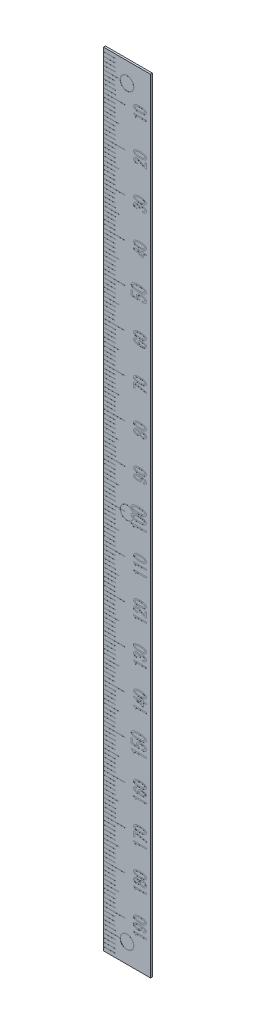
SolidWorks part; units mm, degrees
ref_plane "Front" through (0, 0, 0) normal (0, 0, 1) x (1, 0, 0)
ref_plane "Top" through (0, 0, 0) normal (0, 1, 0) x (1, 0, 0)
ref_plane "Right" through (0, 0, 0) normal (1, 0, 0) x (0, 0, -1)
sketch "Sketch1" plane through (0, 0, 0) normal (0, 0, 1) x (1, 0, 0)
  line L1 (0, 0) -> (0, 200)
  line L2 (0, 0) -> (12, 0)
  line L3 (12, 0) -> (12, 200)
  line L4 (0, 200) -> (12, 200)
  dimension "D1" = 200
  dimension "D2" = 12
extrude "Extrude1" add sketch "Sketch1" along normal blind 0.5
sketch "Sketch2" plane through (0, 0, 0.5) normal (0, 0, 1) x (1, 0, 0)
  line L0 (0, 200) -> (0, 0) construction
  line L1 (0, 0) -> (12, 0) construction
  line L2 (12, 200) -> (0, 200) construction
  circle A0 centre (6, 5) radius 1.75
  circle A1 centre (6, 195) radius 1.75
  circle A2 centre (6, 5) radius 1.65
  circle A3 centre (6, 195) radius 1.65
  circle A4 centre (6, 100) radius 1.75
  circle A5 centre (6, 100) radius 1.65
  dimension "D1" = 6
  dimension "D2" = 6
  dimension "D3" = 5
  dimension "D4" = 5
  dimension "D5" = 3.5
  dimension "D6" = 3.5
  dimension "D7" = 0.1
  dimension "D8" = 2
extrude "Extrude2" cut sketch "Sketch2" against normal blind 0.01
sketch "Sketch3" plane through (0, 0, 0.5) normal (0, 0, 1) x (1, 0, 0)
  line L0 (12, 200) -> (0, 200) construction
  line L1 (7.5, 188.25) -> (11, 188.25) construction
  line L2 (7.5, 188.25) -> (7.5, 191.75) construction
  line L3 (7.5, 191.75) -> (11, 191.75) construction
  line L4 (11, 188.25) -> (11, 191.75) construction
  line L6 (11, 178.25) -> (11, 181.75) construction
  line L7 (11, 168.25) -> (11, 171.75) construction
  line L8 (11, 158.25) -> (11, 161.75) construction
  line L9 (11, 148.25) -> (11, 151.75) construction
  line L10 (11, 138.25) -> (11, 141.75) construction
  line L11 (11, 128.25) -> (11, 131.75) construction
  line L12 (11, 118.25) -> (11, 121.75) construction
  line L13 (11, 108.25) -> (11, 111.75) construction
  line L14 (11, 47.2) -> (11, 52.8) construction
  line L15 (11, 37.2) -> (11, 42.8) construction
  line L16 (11, 98.25) -> (11, 101.75) construction
  line L17 (11, 50) -> (-4.9003, 50) construction
  line L18 (11, 27.2) -> (11, 32.8) construction
  line L19 (11, 17.2) -> (11, 22.8) construction
  line L20 (11, 7.2) -> (11, 12.8) construction
  line L21 (11, 97.2) -> (11, 102.8) construction
  line L22 (12, 0) -> (12, 200) construction
  line L23 (11, 87.2) -> (11, 92.8) construction
  line L24 (11, 57.2) -> (11, 62.8) construction
  line L25 (11, 67.2) -> (11, 72.8) construction
  line L26 (11, 77.2) -> (11, 82.8) construction
  text T0 "10" font "ＭＳ ゴシック" height in points 11
  text T1 "20" font "ＭＳ ゴシック" height in points 11
  text T2 "30" font "ＭＳ ゴシック" height in points 11
  text T3 "40" font "ＭＳ ゴシック" height in points 11
  text T4 "50" font "ＭＳ ゴシック" height in points 13
  text T5 "60  " font "ＭＳ ゴシック" height in points 11
  text T6 "70" font "ＭＳ ゴシック" height in points 11
  text T7 "80" font "ＭＳ ゴシック" height in points 11
  text T8 "90" font "ＭＳ ゴシック" height in points 11
  text T9 "150" font "ＭＳ ゴシック" height in points 13
  text T10 "160" font "ＭＳ ゴシック" height in points 11
  text T11 "170" font "ＭＳ ゴシック" height in points 11
  text T12 "180" font "ＭＳ ゴシック" height in points 11
  text T13 "190" font "ＭＳ ゴシック" height in points 11
  text T14 "100" font "ＭＳ ゴシック" height in points 13
  text T15 "110" font "ＭＳ ゴシック" height in points 11
  text T16 "120" font "ＭＳ ゴシック" height in points 11
  text T17 "130" font "ＭＳ ゴシック" height in points 11
  text T18 "140" font "ＭＳ ゴシック" height in points 11
  point P4 (11, 190)
  dimension "D1" = 3.5
  dimension "D2" = 10
  dimension "D3" = 1
  dimension "D4" = 3.5
  dimension "D8" = 5.6
  dimension "D5" = 4
  dimension "D6" = 7
  dimension "D7" = 5
  dimension "D9" = 2
  dimension "D11" = 2
extrude "Extrude3" cut sketch "Sketch3" against normal blind 0.01
sketch "Sketch4" plane through (0, 0, 0.5) normal (0, 0, 1) x (1, 0, 0)
  line L5 (12, 200) -> (0, 200) construction
  line L806 (6, 200) -> (6, 0) construction
  line L807 (0, 0) -> (12, 0) construction
  line L808 (3, 1.05) -> (3, 0.95)
  line L809 (0, 0.95) -> (3, 0.95)
  line L810 (0, 1.05) -> (3, 1.05)
  line L811 (0, 1.05) -> (0, 0.95)
  line L812 (3, 2.05) -> (3, 1.95)
  line L813 (0, 1.95) -> (3, 1.95)
  line L814 (0, 2.05) -> (3, 2.05)
  line L815 (0, 2.05) -> (0, 1.95)
  line L816 (3, 3.05) -> (3, 2.95)
  line L817 (0, 2.95) -> (3, 2.95)
  line L818 (0, 3.05) -> (3, 3.05)
  line L819 (0, 3.05) -> (0, 2.95)
  line L820 (3, 4.05) -> (3, 3.95)
  line L821 (0, 3.95) -> (3, 3.95)
  line L822 (0, 4.05) -> (3, 4.05)
  line L823 (0, 4.05) -> (0, 3.95)
  line L824 (3, 6.05) -> (3, 5.95)
  line L825 (0, 5.95) -> (3, 5.95)
  line L826 (0, 6.05) -> (3, 6.05)
  line L827 (0, 6.05) -> (0, 5.95)
  line L828 (3, 7.05) -> (3, 6.95)
  line L829 (0, 6.95) -> (3, 6.95)
  line L830 (0, 7.05) -> (3, 7.05)
  line L831 (0, 7.05) -> (0, 6.95)
  line L832 (3, 8.05) -> (3, 7.95)
  line L833 (0, 7.95) -> (3, 7.95)
  line L834 (0, 8.05) -> (3, 8.05)
  line L835 (3, 9.05) -> (3, 8.95)
  line L836 (0, 8.95) -> (3, 8.95)
  line L837 (0, 9.05) -> (0, 8.95)
  line L838 (0, 9.05) -> (3, 9.05)
  line L839 (4, 4.95) -> (4, 5.05)
  line L840 (0, 5.05) -> (4, 5.05)
  line L841 (0, 4.95) -> (0, 5.05)
  line L842 (0, 4.95) -> (4, 4.95)
  line L843 (0, 8.05) -> (0, 7.95)
  line L844 (0, 9.95) -> (0, 10.05)
  line L845 (5.5, 9.95) -> (0, 9.95)
  line L846 (5.5, 10.05) -> (5.5, 9.95)
  line L847 (0, 10.05) -> (5.5, 10.05)
  line L848 (3, 11.05) -> (3, 10.95)
  line L849 (0, 10.95) -> (3, 10.95)
  line L850 (0, 11.05) -> (3, 11.05)
  line L851 (0, 11.05) -> (0, 10.95)
  line L852 (3, 12.05) -> (3, 11.95)
  line L853 (0, 11.95) -> (3, 11.95)
  line L854 (0, 12.05) -> (3, 12.05)
  line L855 (0, 12.05) -> (0, 11.95)
  line L856 (3, 13.05) -> (3, 12.95)
  line L857 (0, 12.95) -> (3, 12.95)
  line L858 (0, 13.05) -> (3, 13.05)
  line L859 (0, 13.05) -> (0, 12.95)
  line L860 (3, 14.05) -> (3, 13.95)
  line L861 (0, 13.95) -> (3, 13.95)
  line L862 (0, 14.05) -> (3, 14.05)
  line L863 (0, 14.05) -> (0, 13.95)
  line L864 (3, 16.05) -> (3, 15.95)
  line L865 (0, 15.95) -> (3, 15.95)
  line L866 (0, 16.05) -> (3, 16.05)
  line L867 (0, 16.05) -> (0, 15.95)
  line L868 (3, 17.05) -> (3, 16.95)
  line L869 (0, 16.95) -> (3, 16.95)
  line L870 (0, 17.05) -> (3, 17.05)
  line L871 (0, 17.05) -> (0, 16.95)
  line L872 (3, 18.05) -> (3, 17.95)
  line L873 (0, 17.95) -> (3, 17.95)
  line L874 (0, 18.05) -> (3, 18.05)
  line L875 (3, 19.05) -> (3, 18.95)
  line L876 (0, 18.95) -> (3, 18.95)
  line L877 (0, 19.05) -> (0, 18.95)
  line L878 (0, 19.05) -> (3, 19.05)
  line L879 (4, 14.95) -> (4, 15.05)
  line L880 (0, 15.05) -> (4, 15.05)
  line L881 (0, 14.95) -> (0, 15.05)
  line L882 (0, 14.95) -> (4, 14.95)
  line L883 (0, 18.05) -> (0, 17.95)
  line L884 (0, 19.95) -> (0, 20.05)
  line L885 (5.5, 19.95) -> (0, 19.95)
  line L886 (5.5, 20.05) -> (5.5, 19.95)
  line L887 (0, 20.05) -> (5.5, 20.05)
  line L888 (3, 21.05) -> (3, 20.95)
  line L889 (0, 20.95) -> (3, 20.95)
  line L890 (0, 21.05) -> (3, 21.05)
  line L891 (0, 21.05) -> (0, 20.95)
  line L892 (3, 22.05) -> (3, 21.95)
  line L893 (0, 21.95) -> (3, 21.95)
  line L894 (0, 22.05) -> (3, 22.05)
  line L895 (0, 22.05) -> (0, 21.95)
  line L896 (3, 23.05) -> (3, 22.95)
  line L897 (0, 22.95) -> (3, 22.95)
  line L898 (0, 23.05) -> (3, 23.05)
  line L899 (0, 23.05) -> (0, 22.95)
  line L900 (3, 24.05) -> (3, 23.95)
  line L901 (0, 23.95) -> (3, 23.95)
  line L902 (0, 24.05) -> (3, 24.05)
  line L903 (0, 24.05) -> (0, 23.95)
  line L904 (3, 26.05) -> (3, 25.95)
  line L905 (0, 25.95) -> (3, 25.95)
  line L906 (0, 26.05) -> (3, 26.05)
  line L907 (0, 26.05) -> (0, 25.95)
  line L908 (3, 27.05) -> (3, 26.95)
  line L909 (0, 26.95) -> (3, 26.95)
  line L910 (0, 27.05) -> (3, 27.05)
  line L911 (0, 27.05) -> (0, 26.95)
  line L912 (3, 28.05) -> (3, 27.95)
  line L913 (0, 27.95) -> (3, 27.95)
  line L914 (0, 28.05) -> (3, 28.05)
  line L915 (3, 29.05) -> (3, 28.95)
  line L916 (0, 28.95) -> (3, 28.95)
  line L917 (0, 29.05) -> (0, 28.95)
  line L918 (0, 29.05) -> (3, 29.05)
  line L919 (4, 24.95) -> (4, 25.05)
  line L920 (0, 25.05) -> (4, 25.05)
  line L921 (0, 24.95) -> (0, 25.05)
  line L922 (0, 24.95) -> (4, 24.95)
  line L923 (0, 28.05) -> (0, 27.95)
  line L924 (0, 29.95) -> (0, 30.05)
  line L925 (5.5, 29.95) -> (0, 29.95)
  line L926 (5.5, 30.05) -> (5.5, 29.95)
  line L927 (0, 30.05) -> (5.5, 30.05)
  line L928 (3, 31.05) -> (3, 30.95)
  line L929 (0, 30.95) -> (3, 30.95)
  line L930 (0, 31.05) -> (3, 31.05)
  line L931 (0, 31.05) -> (0, 30.95)
  line L932 (3, 32.05) -> (3, 31.95)
  line L933 (0, 31.95) -> (3, 31.95)
  line L934 (0, 32.05) -> (3, 32.05)
  line L935 (0, 32.05) -> (0, 31.95)
  line L936 (3, 33.05) -> (3, 32.95)
  line L937 (0, 32.95) -> (3, 32.95)
  line L938 (0, 33.05) -> (3, 33.05)
  line L939 (0, 33.05) -> (0, 32.95)
  line L940 (3, 34.05) -> (3, 33.95)
  line L941 (0, 33.95) -> (3, 33.95)
  line L942 (0, 34.05) -> (3, 34.05)
  line L943 (0, 34.05) -> (0, 33.95)
  line L944 (3, 36.05) -> (3, 35.95)
  line L945 (0, 35.95) -> (3, 35.95)
  line L946 (0, 36.05) -> (3, 36.05)
  line L947 (0, 36.05) -> (0, 35.95)
  line L948 (3, 37.05) -> (3, 36.95)
  line L949 (0, 36.95) -> (3, 36.95)
  line L950 (0, 37.05) -> (3, 37.05)
  line L951 (0, 37.05) -> (0, 36.95)
  line L952 (3, 38.05) -> (3, 37.95)
  line L953 (0, 37.95) -> (3, 37.95)
  line L954 (0, 38.05) -> (3, 38.05)
  line L955 (3, 39.05) -> (3, 38.95)
  line L956 (0, 38.95) -> (3, 38.95)
  line L957 (0, 39.05) -> (0, 38.95)
  line L958 (0, 39.05) -> (3, 39.05)
  line L959 (4, 34.95) -> (4, 35.05)
  line L960 (0, 35.05) -> (4, 35.05)
  line L961 (0, 34.95) -> (0, 35.05)
  line L962 (0, 34.95) -> (4, 34.95)
  line L963 (0, 38.05) -> (0, 37.95)
  line L964 (0, 39.95) -> (0, 40.05)
  line L965 (5.5, 39.95) -> (0, 39.95)
  line L966 (5.5, 40.05) -> (5.5, 39.95)
  line L967 (0, 40.05) -> (5.5, 40.05)
  line L968 (3, 41.05) -> (3, 40.95)
  line L969 (0, 40.95) -> (3, 40.95)
  line L970 (0, 41.05) -> (3, 41.05)
  line L971 (0, 41.05) -> (0, 40.95)
  line L972 (3, 42.05) -> (3, 41.95)
  line L973 (0, 41.95) -> (3, 41.95)
  line L974 (0, 42.05) -> (3, 42.05)
  line L975 (0, 42.05) -> (0, 41.95)
  line L976 (3, 43.05) -> (3, 42.95)
  line L977 (0, 42.95) -> (3, 42.95)
  line L978 (0, 43.05) -> (3, 43.05)
  line L979 (0, 43.05) -> (0, 42.95)
  line L980 (3, 44.05) -> (3, 43.95)
  line L981 (0, 43.95) -> (3, 43.95)
  line L982 (0, 44.05) -> (3, 44.05)
  line L983 (0, 44.05) -> (0, 43.95)
  line L984 (3, 46.05) -> (3, 45.95)
  line L985 (0, 45.95) -> (3, 45.95)
  line L986 (0, 46.05) -> (3, 46.05)
  line L987 (0, 46.05) -> (0, 45.95)
  line L988 (3, 47.05) -> (3, 46.95)
  line L989 (0, 46.95) -> (3, 46.95)
  line L990 (0, 47.05) -> (3, 47.05)
  line L991 (0, 47.05) -> (0, 46.95)
  line L992 (3, 48.05) -> (3, 47.95)
  line L993 (0, 47.95) -> (3, 47.95)
  line L994 (0, 48.05) -> (3, 48.05)
  line L995 (3, 49.05) -> (3, 48.95)
  line L996 (0, 48.95) -> (3, 48.95)
  line L997 (0, 49.05) -> (0, 48.95)
  line L998 (0, 49.05) -> (3, 49.05)
  line L999 (4, 44.95) -> (4, 45.05)
  line L1000 (0, 45.05) -> (4, 45.05)
  line L1001 (0, 44.95) -> (0, 45.05)
  line L1002 (0, 44.95) -> (4, 44.95)
  line L1003 (0, 48.05) -> (0, 47.95)
  line L1004 (0, 49.95) -> (0, 50.05)
  line L1005 (5.5, 49.95) -> (0, 49.95)
  line L1006 (5.5, 50.05) -> (5.5, 49.95)
  line L1007 (0, 50.05) -> (5.5, 50.05)
  line L1008 (3, 51.05) -> (3, 50.95)
  line L1009 (0, 50.95) -> (3, 50.95)
  line L1010 (0, 51.05) -> (3, 51.05)
  line L1011 (0, 51.05) -> (0, 50.95)
  line L1012 (3, 52.05) -> (3, 51.95)
  line L1013 (0, 51.95) -> (3, 51.95)
  line L1014 (0, 52.05) -> (3, 52.05)
  line L1015 (0, 52.05) -> (0, 51.95)
  line L1016 (3, 53.05) -> (3, 52.95)
  line L1017 (0, 52.95) -> (3, 52.95)
  line L1018 (0, 53.05) -> (3, 53.05)
  line L1019 (0, 53.05) -> (0, 52.95)
  line L1020 (3, 54.05) -> (3, 53.95)
  line L1021 (0, 53.95) -> (3, 53.95)
  line L1022 (0, 54.05) -> (3, 54.05)
  line L1023 (0, 54.05) -> (0, 53.95)
  line L1024 (3, 56.05) -> (3, 55.95)
  line L1025 (0, 55.95) -> (3, 55.95)
  line L1026 (0, 56.05) -> (3, 56.05)
  line L1027 (0, 56.05) -> (0, 55.95)
  line L1028 (3, 57.05) -> (3, 56.95)
  line L1029 (0, 56.95) -> (3, 56.95)
  line L1030 (0, 57.05) -> (3, 57.05)
  line L1031 (0, 57.05) -> (0, 56.95)
  line L1032 (3, 58.05) -> (3, 57.95)
  line L1033 (0, 57.95) -> (3, 57.95)
  line L1034 (0, 58.05) -> (3, 58.05)
  line L1035 (3, 59.05) -> (3, 58.95)
  line L1036 (0, 58.95) -> (3, 58.95)
  line L1037 (0, 59.05) -> (0, 58.95)
  line L1038 (0, 59.05) -> (3, 59.05)
  line L1039 (4, 54.95) -> (4, 55.05)
  line L1040 (0, 55.05) -> (4, 55.05)
  line L1041 (0, 54.95) -> (0, 55.05)
  line L1042 (0, 54.95) -> (4, 54.95)
  line L1043 (0, 58.05) -> (0, 57.95)
  line L1044 (0, 59.95) -> (0, 60.05)
  line L1045 (5.5, 59.95) -> (0, 59.95)
  line L1046 (5.5, 60.05) -> (5.5, 59.95)
  line L1047 (0, 60.05) -> (5.5, 60.05)
  line L1048 (3, 61.05) -> (3, 60.95)
  line L1049 (0, 60.95) -> (3, 60.95)
  line L1050 (0, 61.05) -> (3, 61.05)
  line L1051 (0, 61.05) -> (0, 60.95)
  line L1052 (3, 62.05) -> (3, 61.95)
  line L1053 (0, 61.95) -> (3, 61.95)
  line L1054 (0, 62.05) -> (3, 62.05)
  line L1055 (0, 62.05) -> (0, 61.95)
  line L1056 (3, 63.05) -> (3, 62.95)
  line L1057 (0, 62.95) -> (3, 62.95)
  line L1058 (0, 63.05) -> (3, 63.05)
  line L1059 (0, 63.05) -> (0, 62.95)
  line L1060 (3, 64.05) -> (3, 63.95)
  line L1061 (0, 63.95) -> (3, 63.95)
  line L1062 (0, 64.05) -> (3, 64.05)
  line L1063 (0, 64.05) -> (0, 63.95)
  line L1064 (3, 66.05) -> (3, 65.95)
  line L1065 (0, 65.95) -> (3, 65.95)
  line L1066 (0, 66.05) -> (3, 66.05)
  line L1067 (0, 66.05) -> (0, 65.95)
  line L1068 (3, 67.05) -> (3, 66.95)
  line L1069 (0, 66.95) -> (3, 66.95)
  line L1070 (0, 67.05) -> (3, 67.05)
  line L1071 (0, 67.05) -> (0, 66.95)
  line L1072 (3, 68.05) -> (3, 67.95)
  line L1073 (0, 67.95) -> (3, 67.95)
  line L1074 (0, 68.05) -> (3, 68.05)
  line L1075 (3, 69.05) -> (3, 68.95)
  line L1076 (0, 68.95) -> (3, 68.95)
  line L1077 (0, 69.05) -> (0, 68.95)
  line L1078 (0, 69.05) -> (3, 69.05)
  line L1079 (4, 64.95) -> (4, 65.05)
  line L1080 (0, 65.05) -> (4, 65.05)
  line L1081 (0, 64.95) -> (0, 65.05)
  line L1082 (0, 64.95) -> (4, 64.95)
  line L1083 (0, 68.05) -> (0, 67.95)
  line L1084 (0, 69.95) -> (0, 70.05)
  line L1085 (5.5, 69.95) -> (0, 69.95)
  line L1086 (5.5, 70.05) -> (5.5, 69.95)
  line L1087 (0, 70.05) -> (5.5, 70.05)
  line L1088 (3, 71.05) -> (3, 70.95)
  line L1089 (0, 70.95) -> (3, 70.95)
  line L1090 (0, 71.05) -> (3, 71.05)
  line L1091 (0, 71.05) -> (0, 70.95)
  line L1092 (3, 72.05) -> (3, 71.95)
  line L1093 (0, 71.95) -> (3, 71.95)
  line L1094 (0, 72.05) -> (3, 72.05)
  line L1095 (0, 72.05) -> (0, 71.95)
  line L1096 (3, 73.05) -> (3, 72.95)
  line L1097 (0, 72.95) -> (3, 72.95)
  line L1098 (0, 73.05) -> (3, 73.05)
  line L1099 (0, 73.05) -> (0, 72.95)
  line L1100 (3, 74.05) -> (3, 73.95)
  line L1101 (0, 73.95) -> (3, 73.95)
  line L1102 (0, 74.05) -> (3, 74.05)
  line L1103 (0, 74.05) -> (0, 73.95)
  line L1104 (3, 76.05) -> (3, 75.95)
  line L1105 (0, 75.95) -> (3, 75.95)
  line L1106 (0, 76.05) -> (3, 76.05)
  line L1107 (0, 76.05) -> (0, 75.95)
  line L1108 (3, 77.05) -> (3, 76.95)
  line L1109 (0, 76.95) -> (3, 76.95)
  line L1110 (0, 77.05) -> (3, 77.05)
  line L1111 (0, 77.05) -> (0, 76.95)
  line L1112 (3, 78.05) -> (3, 77.95)
  line L1113 (0, 77.95) -> (3, 77.95)
  line L1114 (0, 78.05) -> (3, 78.05)
  line L1115 (3, 79.05) -> (3, 78.95)
  line L1116 (0, 78.95) -> (3, 78.95)
  line L1117 (0, 79.05) -> (0, 78.95)
  line L1118 (0, 79.05) -> (3, 79.05)
  line L1119 (4, 74.95) -> (4, 75.05)
  line L1120 (0, 75.05) -> (4, 75.05)
  line L1121 (0, 74.95) -> (0, 75.05)
  line L1122 (0, 74.95) -> (4, 74.95)
  line L1123 (0, 78.05) -> (0, 77.95)
  line L1124 (0, 79.95) -> (0, 80.05)
  line L1125 (5.5, 79.95) -> (0, 79.95)
  line L1126 (5.5, 80.05) -> (5.5, 79.95)
  line L1127 (0, 80.05) -> (5.5, 80.05)
  line L1128 (3, 81.05) -> (3, 80.95)
  line L1129 (0, 80.95) -> (3, 80.95)
  line L1130 (0, 81.05) -> (3, 81.05)
  line L1131 (0, 81.05) -> (0, 80.95)
  line L1132 (3, 82.05) -> (3, 81.95)
  line L1133 (0, 81.95) -> (3, 81.95)
  line L1134 (0, 82.05) -> (3, 82.05)
  line L1135 (0, 82.05) -> (0, 81.95)
  line L1136 (3, 83.05) -> (3, 82.95)
  line L1137 (0, 82.95) -> (3, 82.95)
  line L1138 (0, 83.05) -> (3, 83.05)
  line L1139 (0, 83.05) -> (0, 82.95)
  line L1140 (3, 84.05) -> (3, 83.95)
  line L1141 (0, 83.95) -> (3, 83.95)
  line L1142 (0, 84.05) -> (3, 84.05)
  line L1143 (0, 84.05) -> (0, 83.95)
  line L1144 (3, 86.05) -> (3, 85.95)
  line L1145 (0, 85.95) -> (3, 85.95)
  line L1146 (0, 86.05) -> (3, 86.05)
  line L1147 (0, 86.05) -> (0, 85.95)
  line L1148 (3, 87.05) -> (3, 86.95)
  line L1149 (0, 86.95) -> (3, 86.95)
  line L1150 (0, 87.05) -> (3, 87.05)
  line L1151 (0, 87.05) -> (0, 86.95)
  line L1152 (3, 88.05) -> (3, 87.95)
  line L1153 (0, 87.95) -> (3, 87.95)
  line L1154 (0, 88.05) -> (3, 88.05)
  line L1155 (3, 89.05) -> (3, 88.95)
  line L1156 (0, 88.95) -> (3, 88.95)
  line L1157 (0, 89.05) -> (0, 88.95)
  line L1158 (0, 89.05) -> (3, 89.05)
  line L1159 (4, 84.95) -> (4, 85.05)
  line L1160 (0, 85.05) -> (4, 85.05)
  line L1161 (0, 84.95) -> (0, 85.05)
  line L1162 (0, 84.95) -> (4, 84.95)
  line L1163 (0, 88.05) -> (0, 87.95)
  line L1164 (0, 89.95) -> (0, 90.05)
  line L1165 (5.5, 89.95) -> (0, 89.95)
  line L1166 (5.5, 90.05) -> (5.5, 89.95)
  line L1167 (0, 90.05) -> (5.5, 90.05)
  line L1168 (3, 91.05) -> (3, 90.95)
  line L1169 (0, 90.95) -> (3, 90.95)
  line L1170 (0, 91.05) -> (3, 91.05)
  line L1171 (0, 91.05) -> (0, 90.95)
  line L1172 (3, 92.05) -> (3, 91.95)
  line L1173 (0, 91.95) -> (3, 91.95)
  line L1174 (0, 92.05) -> (3, 92.05)
  line L1175 (0, 92.05) -> (0, 91.95)
  line L1176 (3, 93.05) -> (3, 92.95)
  line L1177 (0, 92.95) -> (3, 92.95)
  line L1178 (0, 93.05) -> (3, 93.05)
  line L1179 (0, 93.05) -> (0, 92.95)
  line L1180 (3, 94.05) -> (3, 93.95)
  line L1181 (0, 93.95) -> (3, 93.95)
  line L1182 (0, 94.05) -> (3, 94.05)
  line L1183 (0, 94.05) -> (0, 93.95)
  line L1184 (3, 96.05) -> (3, 95.95)
  line L1185 (0, 95.95) -> (3, 95.95)
  line L1186 (0, 96.05) -> (3, 96.05)
  line L1187 (0, 96.05) -> (0, 95.95)
  line L1188 (3, 97.05) -> (3, 96.95)
  line L1189 (0, 96.95) -> (3, 96.95)
  line L1190 (0, 97.05) -> (3, 97.05)
  line L1191 (0, 97.05) -> (0, 96.95)
  line L1192 (3, 98.05) -> (3, 97.95)
  line L1193 (0, 97.95) -> (3, 97.95)
  line L1194 (0, 98.05) -> (3, 98.05)
  line L1195 (3, 99.05) -> (3, 98.95)
  line L1196 (0, 98.95) -> (3, 98.95)
  line L1197 (0, 99.05) -> (0, 98.95)
  line L1198 (0, 99.05) -> (3, 99.05)
  line L1199 (4, 94.95) -> (4, 95.05)
  line L1200 (0, 95.05) -> (4, 95.05)
  line L1201 (0, 94.95) -> (0, 95.05)
  line L1202 (0, 94.95) -> (4, 94.95)
  line L1203 (0, 98.05) -> (0, 97.95)
  line L1204 (0, 99.95) -> (0, 100.05)
  line L1205 (5.5, 99.95) -> (0, 99.95)
  line L1206 (5.5, 100.05) -> (5.5, 99.95)
  line L1207 (0, 100.05) -> (5.5, 100.05)
  line L1208 (3, 101.05) -> (3, 100.95)
  line L1209 (0, 100.95) -> (3, 100.95)
  line L1210 (0, 101.05) -> (3, 101.05)
  line L1211 (0, 101.05) -> (0, 100.95)
  line L1212 (3, 102.05) -> (3, 101.95)
  line L1213 (0, 101.95) -> (3, 101.95)
  line L1214 (0, 102.05) -> (3, 102.05)
  line L1215 (0, 102.05) -> (0, 101.95)
  line L1216 (3, 103.05) -> (3, 102.95)
  line L1217 (0, 102.95) -> (3, 102.95)
  line L1218 (0, 103.05) -> (3, 103.05)
  line L1219 (0, 103.05) -> (0, 102.95)
  line L1220 (3, 104.05) -> (3, 103.95)
  line L1221 (0, 103.95) -> (3, 103.95)
  line L1222 (0, 104.05) -> (3, 104.05)
  line L1223 (0, 104.05) -> (0, 103.95)
  line L1224 (3, 106.05) -> (3, 105.95)
  line L1225 (0, 105.95) -> (3, 105.95)
  line L1226 (0, 106.05) -> (3, 106.05)
  line L1227 (0, 106.05) -> (0, 105.95)
  line L1228 (3, 107.05) -> (3, 106.95)
  line L1229 (0, 106.95) -> (3, 106.95)
  line L1230 (0, 107.05) -> (3, 107.05)
  line L1231 (0, 107.05) -> (0, 106.95)
  line L1232 (3, 108.05) -> (3, 107.95)
  line L1233 (0, 107.95) -> (3, 107.95)
  line L1234 (0, 108.05) -> (3, 108.05)
  line L1235 (3, 109.05) -> (3, 108.95)
  line L1236 (0, 108.95) -> (3, 108.95)
  line L1237 (0, 109.05) -> (0, 108.95)
  line L1238 (0, 109.05) -> (3, 109.05)
  line L1239 (4, 104.95) -> (4, 105.05)
  line L1240 (0, 105.05) -> (4, 105.05)
  line L1241 (0, 104.95) -> (0, 105.05)
  line L1242 (0, 104.95) -> (4, 104.95)
  line L1243 (0, 108.05) -> (0, 107.95)
  line L1244 (0, 109.95) -> (0, 110.05)
  line L1245 (5.5, 109.95) -> (0, 109.95)
  line L1246 (5.5, 110.05) -> (5.5, 109.95)
  line L1247 (0, 110.05) -> (5.5, 110.05)
  line L1248 (3, 111.05) -> (3, 110.95)
  line L1249 (0, 110.95) -> (3, 110.95)
  line L1250 (0, 111.05) -> (3, 111.05)
  line L1251 (0, 111.05) -> (0, 110.95)
  line L1252 (3, 112.05) -> (3, 111.95)
  line L1253 (0, 111.95) -> (3, 111.95)
  line L1254 (0, 112.05) -> (3, 112.05)
  line L1255 (0, 112.05) -> (0, 111.95)
  line L1256 (3, 113.05) -> (3, 112.95)
  line L1257 (0, 112.95) -> (3, 112.95)
  line L1258 (0, 113.05) -> (3, 113.05)
  line L1259 (0, 113.05) -> (0, 112.95)
  line L1260 (3, 114.05) -> (3, 113.95)
  line L1261 (0, 113.95) -> (3, 113.95)
  line L1262 (0, 114.05) -> (3, 114.05)
  line L1263 (0, 114.05) -> (0, 113.95)
  line L1264 (3, 116.05) -> (3, 115.95)
  line L1265 (0, 115.95) -> (3, 115.95)
  line L1266 (0, 116.05) -> (3, 116.05)
  line L1267 (0, 116.05) -> (0, 115.95)
  line L1268 (3, 117.05) -> (3, 116.95)
  line L1269 (0, 116.95) -> (3, 116.95)
  line L1270 (0, 117.05) -> (3, 117.05)
  line L1271 (0, 117.05) -> (0, 116.95)
  line L1272 (3, 118.05) -> (3, 117.95)
  line L1273 (0, 117.95) -> (3, 117.95)
  line L1274 (0, 118.05) -> (3, 118.05)
  line L1275 (3, 119.05) -> (3, 118.95)
  line L1276 (0, 118.95) -> (3, 118.95)
  line L1277 (0, 119.05) -> (0, 118.95)
  line L1278 (0, 119.05) -> (3, 119.05)
  line L1279 (4, 114.95) -> (4, 115.05)
  line L1280 (0, 115.05) -> (4, 115.05)
  line L1281 (0, 114.95) -> (0, 115.05)
  line L1282 (0, 114.95) -> (4, 114.95)
  line L1283 (0, 118.05) -> (0, 117.95)
  line L1284 (0, 119.95) -> (0, 120.05)
  line L1285 (5.5, 119.95) -> (0, 119.95)
  line L1286 (5.5, 120.05) -> (5.5, 119.95)
  line L1287 (0, 120.05) -> (5.5, 120.05)
  line L1288 (3, 121.05) -> (3, 120.95)
  line L1289 (0, 120.95) -> (3, 120.95)
  line L1290 (0, 121.05) -> (3, 121.05)
  line L1291 (0, 121.05) -> (0, 120.95)
  line L1292 (3, 122.05) -> (3, 121.95)
  line L1293 (0, 121.95) -> (3, 121.95)
  line L1294 (0, 122.05) -> (3, 122.05)
  line L1295 (0, 122.05) -> (0, 121.95)
  line L1296 (3, 123.05) -> (3, 122.95)
  line L1297 (0, 122.95) -> (3, 122.95)
  line L1298 (0, 123.05) -> (3, 123.05)
  line L1299 (0, 123.05) -> (0, 122.95)
  line L1300 (3, 124.05) -> (3, 123.95)
  line L1301 (0, 123.95) -> (3, 123.95)
  line L1302 (0, 124.05) -> (3, 124.05)
  line L1303 (0, 124.05) -> (0, 123.95)
  line L1304 (3, 126.05) -> (3, 125.95)
  line L1305 (0, 125.95) -> (3, 125.95)
  line L1306 (0, 126.05) -> (3, 126.05)
  line L1307 (0, 126.05) -> (0, 125.95)
  line L1308 (3, 127.05) -> (3, 126.95)
  line L1309 (0, 126.95) -> (3, 126.95)
  line L1310 (0, 127.05) -> (3, 127.05)
  line L1311 (0, 127.05) -> (0, 126.95)
  line L1312 (3, 128.05) -> (3, 127.95)
  line L1313 (0, 127.95) -> (3, 127.95)
  line L1314 (0, 128.05) -> (3, 128.05)
  line L1315 (3, 129.05) -> (3, 128.95)
  line L1316 (0, 128.95) -> (3, 128.95)
  line L1317 (0, 129.05) -> (0, 128.95)
  line L1318 (0, 129.05) -> (3, 129.05)
  line L1319 (4, 124.95) -> (4, 125.05)
  line L1320 (0, 125.05) -> (4, 125.05)
  line L1321 (0, 124.95) -> (0, 125.05)
  line L1322 (0, 124.95) -> (4, 124.95)
  line L1323 (0, 128.05) -> (0, 127.95)
  line L1324 (0, 129.95) -> (0, 130.05)
  line L1325 (5.5, 129.95) -> (0, 129.95)
  line L1326 (5.5, 130.05) -> (5.5, 129.95)
  line L1327 (0, 130.05) -> (5.5, 130.05)
  line L1328 (3, 131.05) -> (3, 130.95)
  line L1329 (0, 130.95) -> (3, 130.95)
  line L1330 (0, 131.05) -> (3, 131.05)
  line L1331 (0, 131.05) -> (0, 130.95)
  line L1332 (3, 132.05) -> (3, 131.95)
  line L1333 (0, 131.95) -> (3, 131.95)
  line L1334 (0, 132.05) -> (3, 132.05)
  line L1335 (0, 132.05) -> (0, 131.95)
  line L1336 (3, 133.05) -> (3, 132.95)
  line L1337 (0, 132.95) -> (3, 132.95)
  line L1338 (0, 133.05) -> (3, 133.05)
  line L1339 (0, 133.05) -> (0, 132.95)
  line L1340 (3, 134.05) -> (3, 133.95)
  line L1341 (0, 133.95) -> (3, 133.95)
  line L1342 (0, 134.05) -> (3, 134.05)
  line L1343 (0, 134.05) -> (0, 133.95)
  line L1344 (3, 136.05) -> (3, 135.95)
  line L1345 (0, 135.95) -> (3, 135.95)
  line L1346 (0, 136.05) -> (3, 136.05)
  line L1347 (0, 136.05) -> (0, 135.95)
  line L1348 (3, 137.05) -> (3, 136.95)
  line L1349 (0, 136.95) -> (3, 136.95)
  line L1350 (0, 137.05) -> (3, 137.05)
  line L1351 (0, 137.05) -> (0, 136.95)
  line L1352 (3, 138.05) -> (3, 137.95)
  line L1353 (0, 137.95) -> (3, 137.95)
  line L1354 (0, 138.05) -> (3, 138.05)
  line L1355 (3, 139.05) -> (3, 138.95)
  line L1356 (0, 138.95) -> (3, 138.95)
  line L1357 (0, 139.05) -> (0, 138.95)
  line L1358 (0, 139.05) -> (3, 139.05)
  line L1359 (4, 134.95) -> (4, 135.05)
  line L1360 (0, 135.05) -> (4, 135.05)
  line L1361 (0, 134.95) -> (0, 135.05)
  line L1362 (0, 134.95) -> (4, 134.95)
  line L1363 (0, 138.05) -> (0, 137.95)
  line L1364 (0, 139.95) -> (0, 140.05)
  line L1365 (5.5, 139.95) -> (0, 139.95)
  line L1366 (5.5, 140.05) -> (5.5, 139.95)
  line L1367 (0, 140.05) -> (5.5, 140.05)
  line L1368 (3, 141.05) -> (3, 140.95)
  line L1369 (0, 140.95) -> (3, 140.95)
  line L1370 (0, 141.05) -> (3, 141.05)
  line L1371 (0, 141.05) -> (0, 140.95)
  line L1372 (3, 142.05) -> (3, 141.95)
  line L1373 (0, 141.95) -> (3, 141.95)
  line L1374 (0, 142.05) -> (3, 142.05)
  line L1375 (0, 142.05) -> (0, 141.95)
  line L1376 (3, 143.05) -> (3, 142.95)
  line L1377 (0, 142.95) -> (3, 142.95)
  line L1378 (0, 143.05) -> (3, 143.05)
  line L1379 (0, 143.05) -> (0, 142.95)
  line L1380 (3, 144.05) -> (3, 143.95)
  line L1381 (0, 143.95) -> (3, 143.95)
  line L1382 (0, 144.05) -> (3, 144.05)
  line L1383 (0, 144.05) -> (0, 143.95)
  line L1384 (3, 146.05) -> (3, 145.95)
  line L1385 (0, 145.95) -> (3, 145.95)
  line L1386 (0, 146.05) -> (3, 146.05)
  line L1387 (0, 146.05) -> (0, 145.95)
  line L1388 (3, 147.05) -> (3, 146.95)
  line L1389 (0, 146.95) -> (3, 146.95)
  line L1390 (0, 147.05) -> (3, 147.05)
  line L1391 (0, 147.05) -> (0, 146.95)
  line L1392 (3, 148.05) -> (3, 147.95)
  line L1393 (0, 147.95) -> (3, 147.95)
  line L1394 (0, 148.05) -> (3, 148.05)
  line L1395 (3, 149.05) -> (3, 148.95)
  line L1396 (0, 148.95) -> (3, 148.95)
  line L1397 (0, 149.05) -> (0, 148.95)
  line L1398 (0, 149.05) -> (3, 149.05)
  line L1399 (4, 144.95) -> (4, 145.05)
  line L1400 (0, 145.05) -> (4, 145.05)
  line L1401 (0, 144.95) -> (0, 145.05)
  line L1402 (0, 144.95) -> (4, 144.95)
  line L1403 (0, 148.05) -> (0, 147.95)
  line L1404 (3, 151.05) -> (3, 150.95)
  line L1405 (0, 150.95) -> (3, 150.95)
  line L1406 (0, 151.05) -> (3, 151.05)
  line L1407 (0, 151.05) -> (0, 150.95)
  line L1408 (3, 152.05) -> (3, 151.95)
  line L1409 (0, 151.95) -> (3, 151.95)
  line L1410 (0, 152.05) -> (3, 152.05)
  line L1411 (0, 152.05) -> (0, 151.95)
  line L1412 (3, 153.05) -> (3, 152.95)
  line L1413 (0, 152.95) -> (3, 152.95)
  line L1414 (0, 153.05) -> (3, 153.05)
  line L1415 (0, 153.05) -> (0, 152.95)
  line L1416 (3, 154.05) -> (3, 153.95)
  line L1417 (0, 153.95) -> (3, 153.95)
  line L1418 (0, 154.05) -> (3, 154.05)
  line L1419 (0, 154.05) -> (0, 153.95)
  line L1420 (3, 156.05) -> (3, 155.95)
  line L1421 (0, 155.95) -> (3, 155.95)
  line L1422 (0, 156.05) -> (3, 156.05)
  line L1423 (0, 156.05) -> (0, 155.95)
  line L1424 (3, 157.05) -> (3, 156.95)
  line L1425 (0, 156.95) -> (3, 156.95)
  line L1426 (0, 157.05) -> (3, 157.05)
  line L1427 (0, 157.05) -> (0, 156.95)
  line L1428 (3, 158.05) -> (3, 157.95)
  line L1429 (0, 157.95) -> (3, 157.95)
  line L1430 (0, 158.05) -> (3, 158.05)
  line L1431 (3, 159.05) -> (3, 158.95)
  line L1432 (0, 158.95) -> (3, 158.95)
  line L1433 (0, 159.05) -> (0, 158.95)
  line L1434 (0, 159.05) -> (3, 159.05)
  line L1435 (4, 154.95) -> (4, 155.05)
  line L1436 (0, 155.05) -> (4, 155.05)
  line L1437 (0, 154.95) -> (0, 155.05)
  line L1438 (0, 154.95) -> (4, 154.95)
  line L1439 (0, 158.05) -> (0, 157.95)
  line L1440 (0, 149.95) -> (0, 150.05)
  line L1441 (5.5, 149.95) -> (0, 149.95)
  line L1442 (5.5, 150.05) -> (5.5, 149.95)
  line L1443 (0, 150.05) -> (5.5, 150.05)
  line L1444 (3, 161.05) -> (3, 160.95)
  line L1445 (0, 160.95) -> (3, 160.95)
  line L1446 (0, 161.05) -> (3, 161.05)
  line L1447 (0, 161.05) -> (0, 160.95)
  line L1448 (3, 162.05) -> (3, 161.95)
  line L1449 (0, 161.95) -> (3, 161.95)
  line L1450 (0, 162.05) -> (3, 162.05)
  line L1451 (0, 162.05) -> (0, 161.95)
  line L1452 (3, 163.05) -> (3, 162.95)
  line L1453 (0, 162.95) -> (3, 162.95)
  line L1454 (0, 163.05) -> (3, 163.05)
  line L1455 (0, 163.05) -> (0, 162.95)
  line L1456 (3, 164.05) -> (3, 163.95)
  line L1457 (0, 163.95) -> (3, 163.95)
  line L1458 (0, 164.05) -> (3, 164.05)
  line L1459 (0, 164.05) -> (0, 163.95)
  line L1460 (3, 166.05) -> (3, 165.95)
  line L1461 (0, 165.95) -> (3, 165.95)
  line L1462 (0, 166.05) -> (3, 166.05)
  line L1463 (0, 166.05) -> (0, 165.95)
  line L1464 (3, 167.05) -> (3, 166.95)
  line L1465 (0, 166.95) -> (3, 166.95)
  line L1466 (0, 167.05) -> (3, 167.05)
  line L1467 (0, 167.05) -> (0, 166.95)
  line L1468 (3, 168.05) -> (3, 167.95)
  line L1469 (0, 167.95) -> (3, 167.95)
  line L1470 (0, 168.05) -> (3, 168.05)
  line L1471 (3, 169.05) -> (3, 168.95)
  line L1472 (0, 168.95) -> (3, 168.95)
  line L1473 (0, 169.05) -> (0, 168.95)
  line L1474 (0, 169.05) -> (3, 169.05)
  line L1475 (4, 164.95) -> (4, 165.05)
  line L1476 (0, 165.05) -> (4, 165.05)
  line L1477 (0, 164.95) -> (0, 165.05)
  line L1478 (0, 164.95) -> (4, 164.95)
  line L1479 (0, 168.05) -> (0, 167.95)
  line L1480 (0, 159.95) -> (0, 160.05)
  line L1481 (5.5, 159.95) -> (0, 159.95)
  line L1482 (5.5, 160.05) -> (5.5, 159.95)
  line L1483 (0, 160.05) -> (5.5, 160.05)
  line L1484 (3, 171.05) -> (3, 170.95)
  line L1485 (0, 170.95) -> (3, 170.95)
  line L1486 (0, 171.05) -> (3, 171.05)
  line L1487 (0, 171.05) -> (0, 170.95)
  line L1488 (3, 172.05) -> (3, 171.95)
  line L1489 (0, 171.95) -> (3, 171.95)
  line L1490 (0, 172.05) -> (3, 172.05)
  line L1491 (0, 172.05) -> (0, 171.95)
  line L1492 (3, 173.05) -> (3, 172.95)
  line L1493 (0, 172.95) -> (3, 172.95)
  line L1494 (0, 173.05) -> (3, 173.05)
  line L1495 (0, 173.05) -> (0, 172.95)
  line L1496 (3, 174.05) -> (3, 173.95)
  line L1497 (0, 173.95) -> (3, 173.95)
  line L1498 (0, 174.05) -> (3, 174.05)
  line L1499 (0, 174.05) -> (0, 173.95)
  line L1500 (3, 176.05) -> (3, 175.95)
  line L1501 (0, 175.95) -> (3, 175.95)
  line L1502 (0, 176.05) -> (3, 176.05)
  line L1503 (0, 176.05) -> (0, 175.95)
  line L1504 (3, 177.05) -> (3, 176.95)
  line L1505 (0, 176.95) -> (3, 176.95)
  line L1506 (0, 177.05) -> (3, 177.05)
  line L1507 (0, 177.05) -> (0, 176.95)
  line L1508 (3, 178.05) -> (3, 177.95)
  line L1509 (0, 177.95) -> (3, 177.95)
  line L1510 (0, 178.05) -> (3, 178.05)
  line L1511 (3, 179.05) -> (3, 178.95)
  line L1512 (0, 178.95) -> (3, 178.95)
  line L1513 (0, 179.05) -> (0, 178.95)
  line L1514 (0, 179.05) -> (3, 179.05)
  line L1515 (4, 174.95) -> (4, 175.05)
  line L1516 (0, 175.05) -> (4, 175.05)
  line L1517 (0, 174.95) -> (0, 175.05)
  line L1518 (0, 174.95) -> (4, 174.95)
  line L1519 (0, 178.05) -> (0, 177.95)
  line L1520 (0, 169.95) -> (0, 170.05)
  line L1521 (5.5, 169.95) -> (0, 169.95)
  line L1522 (5.5, 170.05) -> (5.5, 169.95)
  line L1523 (0, 170.05) -> (5.5, 170.05)
  line L1524 (3, 181.05) -> (3, 180.95)
  line L1525 (0, 180.95) -> (3, 180.95)
  line L1526 (0, 181.05) -> (3, 181.05)
  line L1527 (0, 181.05) -> (0, 180.95)
  line L1528 (3, 182.05) -> (3, 181.95)
  line L1529 (0, 181.95) -> (3, 181.95)
  line L1530 (0, 182.05) -> (3, 182.05)
  line L1531 (0, 182.05) -> (0, 181.95)
  line L1532 (0, 183.05) -> (0, 182.95)
  line L1533 (0, 184.05) -> (0, 183.95)
  line L1534 (0, 184.95) -> (0, 185.05)
  line L1535 (0, 179.95) -> (0, 180.05)
  line L1536 (5.5, 179.95) -> (0, 179.95)
  line L1537 (5.5, 180.05) -> (5.5, 179.95)
  line L1538 (0, 180.05) -> (5.5, 180.05)
  line L1539 (3, 183.05) -> (3, 182.95)
  line L1540 (0, 182.95) -> (3, 182.95)
  line L1541 (0, 183.05) -> (3, 183.05)
  line L1542 (3, 184.05) -> (3, 183.95)
  line L1543 (0, 183.95) -> (3, 183.95)
  line L1544 (0, 184.05) -> (3, 184.05)
  line L1545 (3, 186.05) -> (3, 185.95)
  line L1546 (0, 185.95) -> (3, 185.95)
  line L1547 (0, 186.05) -> (3, 186.05)
  line L1548 (0, 186.05) -> (0, 185.95)
  line L1549 (3, 187.05) -> (3, 186.95)
  line L1550 (0, 186.95) -> (3, 186.95)
  line L1551 (0, 187.05) -> (3, 187.05)
  line L1552 (0, 187.05) -> (0, 186.95)
  line L1553 (3, 188.05) -> (3, 187.95)
  line L1554 (0, 187.95) -> (3, 187.95)
  line L1555 (0, 188.05) -> (3, 188.05)
  line L1556 (3, 189.05) -> (3, 188.95)
  line L1557 (0, 188.95) -> (3, 188.95)
  line L1558 (0, 189.05) -> (0, 188.95)
  line L1559 (0, 189.05) -> (3, 189.05)
  line L1560 (4, 184.95) -> (4, 185.05)
  line L1561 (0, 185.05) -> (4, 185.05)
  line L1562 (0, 184.95) -> (4, 184.95)
  line L1563 (0, 188.05) -> (0, 187.95)
  line L1564 (3, 191.05) -> (3, 190.95)
  line L1565 (0, 190.95) -> (3, 190.95)
  line L1566 (0, 191.05) -> (3, 191.05)
  line L1567 (0, 191.05) -> (0, 190.95)
  line L1568 (3, 192.05) -> (3, 191.95)
  line L1569 (0, 191.95) -> (3, 191.95)
  line L1570 (0, 192.05) -> (3, 192.05)
  line L1571 (0, 192.05) -> (0, 191.95)
  line L1572 (3, 193.05) -> (3, 192.95)
  line L1573 (0, 192.95) -> (3, 192.95)
  line L1574 (0, 193.05) -> (3, 193.05)
  line L1575 (0, 193.05) -> (0, 192.95)
  line L1576 (3, 194.05) -> (3, 193.95)
  line L1577 (0, 193.95) -> (3, 193.95)
  line L1578 (0, 194.05) -> (3, 194.05)
  line L1579 (0, 194.05) -> (0, 193.95)
  line L1580 (3, 196.05) -> (3, 195.95)
  line L1581 (0, 195.95) -> (3, 195.95)
  line L1582 (0, 196.05) -> (3, 196.05)
  line L1583 (0, 196.05) -> (0, 195.95)
  line L1584 (3, 197.05) -> (3, 196.95)
  line L1585 (0, 196.95) -> (3, 196.95)
  line L1586 (0, 197.05) -> (3, 197.05)
  line L1587 (0, 197.05) -> (0, 196.95)
  line L1588 (3, 198.05) -> (3, 197.95)
  line L1589 (0, 197.95) -> (3, 197.95)
  line L1590 (0, 198.05) -> (3, 198.05)
  line L1591 (3, 199.05) -> (3, 198.95)
  line L1592 (0, 198.95) -> (3, 198.95)
  line L1593 (0, 199.05) -> (0, 198.95)
  line L1594 (0, 199.05) -> (3, 199.05)
  line L1595 (4, 194.95) -> (4, 195.05)
  line L1596 (0, 195.05) -> (4, 195.05)
  line L1597 (0, 194.95) -> (0, 195.05)
  line L1598 (0, 194.95) -> (4, 194.95)
  line L1599 (0, 198.05) -> (0, 197.95)
  line L1600 (0, 189.95) -> (0, 190.05)
  line L1601 (5.5, 189.95) -> (0, 189.95)
  line L1602 (5.5, 190.05) -> (5.5, 189.95)
  line L1603 (0, 190.05) -> (5.5, 190.05)
extrude "Extrude4" cut sketch "Sketch4" against normal blind 0.01
move or copy body "Body-Move/Copy2" bodies to move or copy 105 copy no translate (-12, -150, 0)
